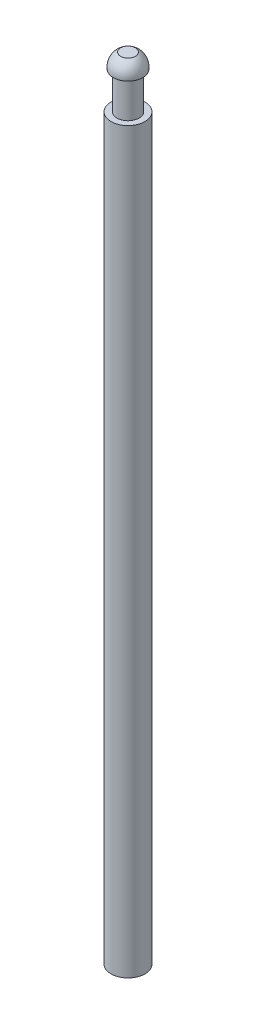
SolidWorks part; units mm, degrees
ref_plane "前视基准面" through (0, 0, 0) normal (0, 0, 1) x (1, 0, 0)
ref_plane "上视基准面" through (0, 0, 0) normal (0, 1, 0) x (1, 0, 0)
ref_plane "右视基准面" through (0, 0, 0) normal (1, 0, 0) x (0, 0, -1)
sketch "草图3" plane through (0, 0, 0) normal (0, 0, 1) x (1, 0, 0)
  line L0 (0, 0) -> (0, 36.8073) construction
  line L1 (-0.75, 35.8073) -> (-1, 35.8073)
  line L2 (-0.5, 36.8073) -> (0, 36.8073)
  line L3 (-0.75, 35.8073) -> (-0.75, 33.3073)
  line L4 (-0.75, 33.3073) -> (0, 33.3073)
  line L5 (0, 36.8073) -> (0, 33.3073)
  arc A0 (-1, 35.8073) -> (-0.5, 36.8073) centre (0, 35.9323) cw
  point P5 (-0.6271, 36.8073)
  dimension "D1" = 1
  dimension "D2" = 2
  dimension "D3" = 1.5
  dimension "D4" = 2.5
  dimension "D5" = 0.5
revolve "旋转1" add sketch "草图3" angle 360 about L0
sketch "草图4" plane through (0, 33.3073, 0) normal (0, -1, 0) x (1, 0, 0)
  circle A0 centre (0, 0) radius 1.15
  dimension "D1" = 2.3
extrude "凸台-拉伸1" add sketch "草图4" along normal blind 50
